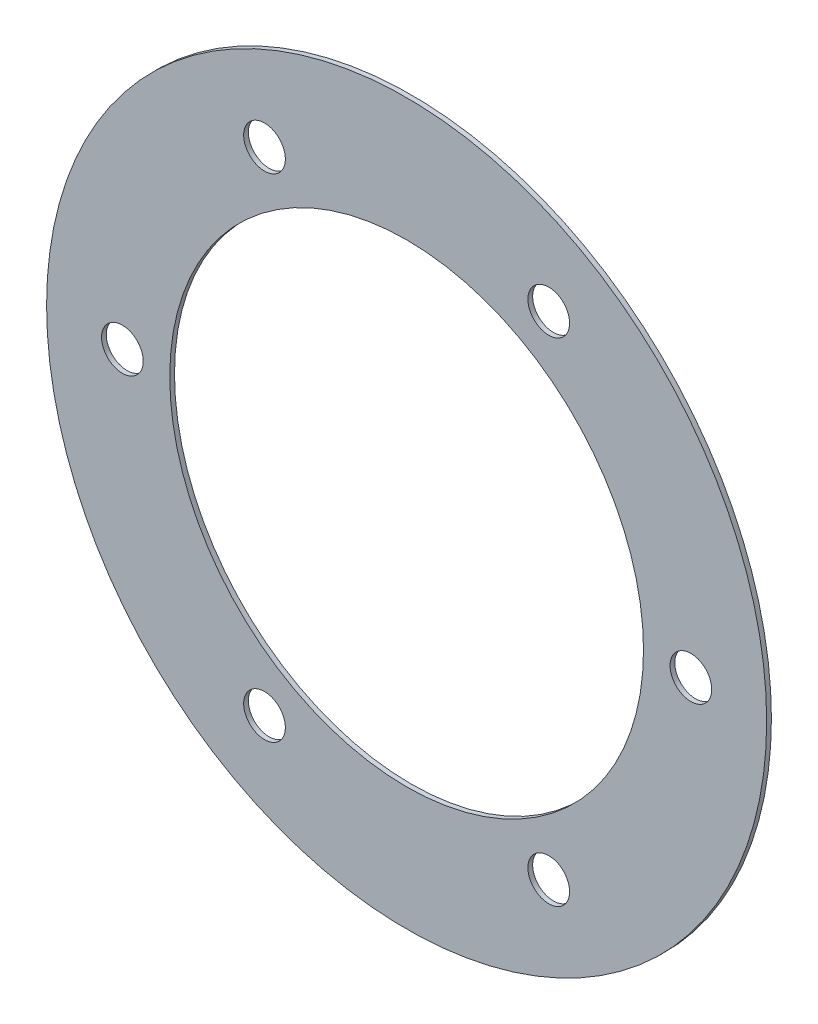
SolidWorks part; units mm, degrees
ref_plane "Plan1" through (0, 0, 0) normal (0, 0, 1) x (1, 0, 0)
ref_plane "Plan2" through (0, 0, 0) normal (0, 1, 0) x (1, 0, 0)
ref_plane "Plan3" through (0, 0, 0) normal (1, 0, 0) x (0, 0, -1)
sketch "Esquisse1" plane through (0, 0, 0) normal (0, 0, 1) x (1, 0, 0)
  circle A0 centre (0, 0) radius 38
  circle A1 centre (0, 0) radius 25
  circle A2 centre (0, 0) radius 25 construction
  circle A3 centre (0, 0) radius 38 construction
extrude "Base-Extrusion" add sketch "Esquisse1" along normal blind 0.5
hole_wizard "Passage vis" positions "Esquisse3" profile "Esquisse2" hole size "M4.4" standard "ISO"
sketch "Esquisse3" plane through (0, 0, 0.5) normal (0, 0, 1) x (1, 0, 0)
  line L0 (0, 0) -> (0, 30) construction
  circle A0 centre (30, 0) radius 1.65 construction
  point P0 (30, 0)
sketch "Esquisse2" plane through (30, 0, 0.5) normal (1, 0, 0) x (0, -1, 0)
  line L0 (0, 0) -> (0, 0.5)
  line L1 (0, 0.5) -> (2.2, 0.5)
  line L2 (2.2, 0.5) -> (2.2, 0)
  line L5 (2.2, 0) -> (0, 0)
  line L11 (0, -6.35) -> (0, 107.95) construction
  dimension "Diamètre du perçage jusqu'au prochain" = 4.4
  dimension "Profondeur du perçage jusqu'au prochain" = 0.5
pattern_circular "Répétition circulaire1" count 6 over 360
